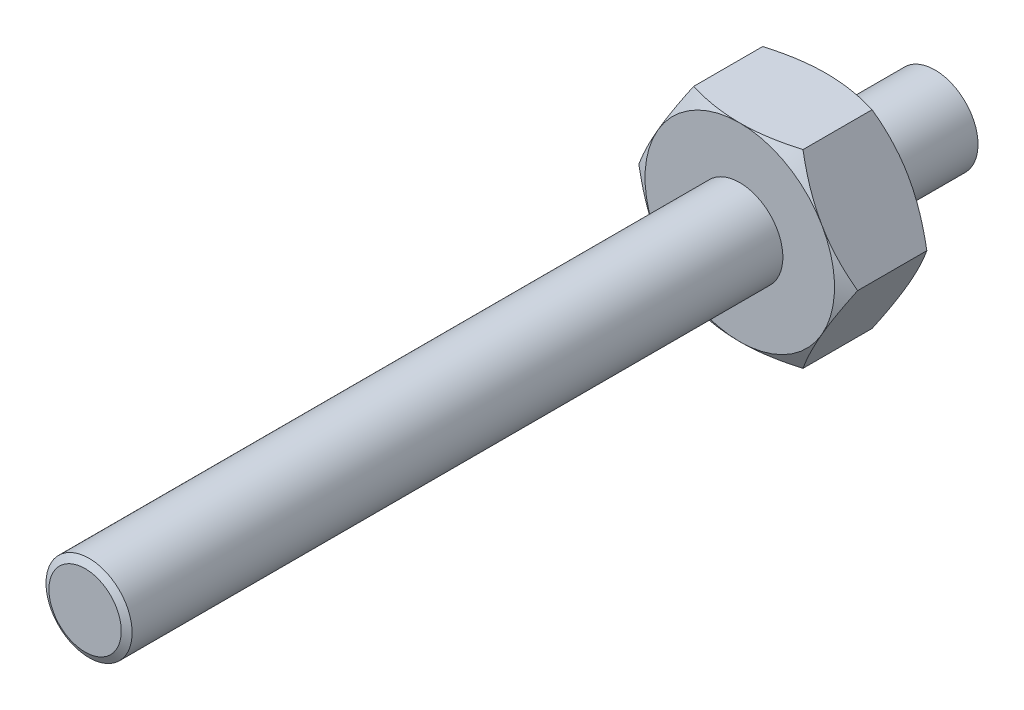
SolidWorks part; units mm, degrees
ref_plane "Plan1" through (0, 0, 0) normal (0, 0, 1) x (1, 0, 0)
ref_plane "Plan2" through (0, 0, 0) normal (0, 1, 0) x (1, 0, 0)
ref_plane "Plan3" through (0, 0, 0) normal (1, 0, 0) x (0, 0, -1)
sketch "Esquisse1" plane through (0, 0, 0) normal (0, 0, 1) x (1, 0, 0)
  line L0 (-6.3509, 11) -> (6.3509, 11)
  line L1 (-6.3509, -11) -> (6.3509, -11)
  line L2 (0, 10) -> (0, -10) construction
  line L3 (-12.7017, 0) -> (12.7017, 0) construction
  line L4 (-6.3509, 11) -> (-12.7017, 0)
  line L5 (6.3509, 11) -> (12.7017, 0)
  line L6 (12.7017, 0) -> (6.3509, -11)
  line L7 (-12.7017, 0) -> (-6.3509, -11)
  dimension "D1" = 11
  dimension "D2" = 11
  dimension "D3" = 60
  dimension "D5" = 11
  dimension "D6" = 11
  dimension "D7" = 60
  dimension "D8" = 60
extrude "Base-Extrusion" add sketch "Esquisse1" along normal blind 100
sketch "Esquisse2" plane through (0, 0, 0) normal (1, 0, 0) x (0, 0, -1)
  line L0 (-14, 13.5) -> (-14, 5)
  line L1 (-14, 5) -> (0, 5)
  line L2 (0, 5) -> (0, 17)
  line L3 (0, 17) -> (-110, 17)
  line L4 (-110, 17) -> (-110, 5)
  line L5 (-110, 5) -> (-24, 5)
  line L6 (-24, 5) -> (-24, 13.5)
  line L7 (-24, 13.5) -> (-14, 13.5)
  line L8 (0, 0) -> (-52.5, 0) construction
  dimension "D1" = 5
  dimension "D2" = 5
  dimension "D3" = 14
  dimension "D4" = 10
revolve "Enlèvement de matière-Révolution1" cut sketch "Esquisse2" angle 360 about L8
sketch "Esquisse4" plane through (0, 0, 0) normal (1, 0, 0) x (0, 0, -1)
  line L0 (-1, 0) -> (-11.5, 0) construction
  line L2 (0, -5) -> (0, 5) construction
  line L4 (-3.8267, 7.8671) -> (0, 7.8671)
  line L6 (0, 0) -> (-52.5, 0) construction
  line L7 (0, 7.8671) -> (0, 0.05)
  arc A0 (0, 0.05) -> (-3.8267, 7.8671) centre (-9.9999, 0) ccw
  dimension "D2" = 0.05
  dimension "D1" = 10
revolve "Enlèvement de matière-Révolution2" cut sketch "Esquisse4" angle 360 about L0
chamfer "Chanfrein1" distance 0.8 angle 30 1 edges at (-5, 0, 100)
sketch "Esquisse5" plane through (0, 0, 0) normal (1, 0, 0) x (0, 0, -1)
  line L0 (-14, 11) -> (-15.0675, 12.849)
  line L1 (-15.0675, 12.849) -> (-22.9325, 12.849)
  line L2 (-22.9325, 12.849) -> (-24, 11)
  line L3 (-24, 11) -> (-24, 14.1868)
  line L4 (-24, 14.1868) -> (-14, 14.1868)
  line L5 (-14, 14.1868) -> (-14, 11)
  line L6 (0, 0) -> (-12.6065, 0) construction
  line L7 (-99.5381, 0) -> (-100, 0) construction
  dimension "D1" = 30
  dimension "D2" = 60
revolve "Enlèvement de matière-Révolution3" cut sketch "Esquisse5" angle 360 about L6
